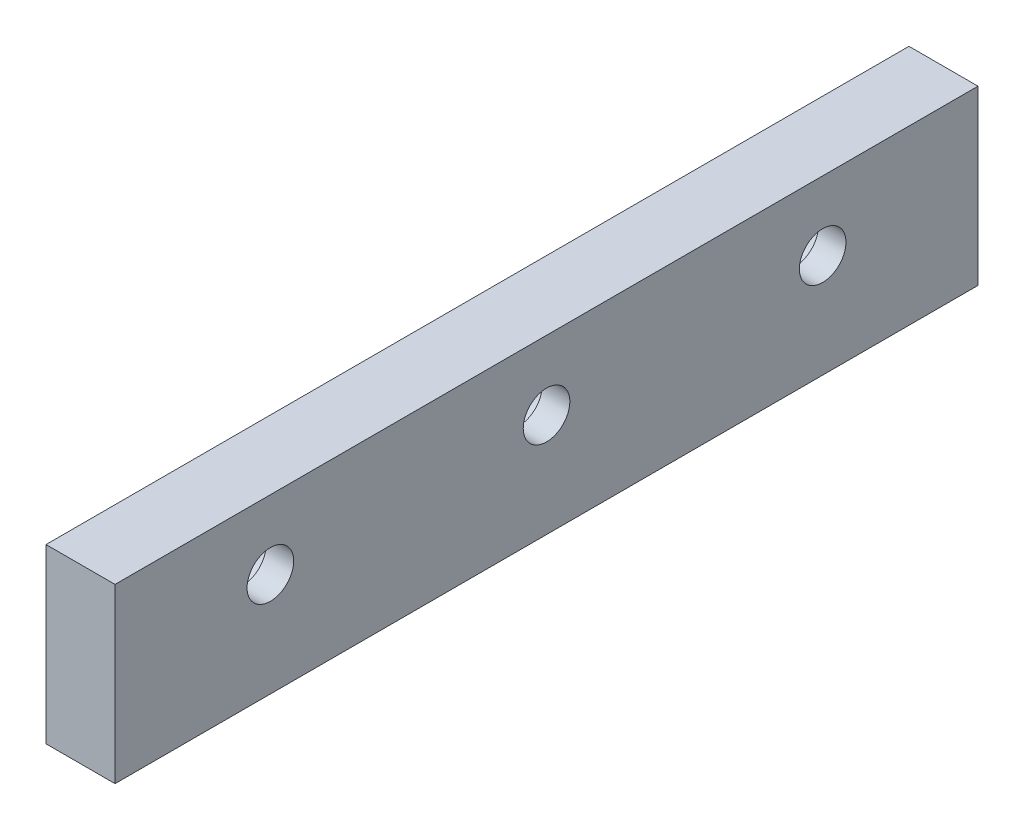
SolidWorks part; units mm, degrees
ref_plane "Plan de face" through (0, 0, 0) normal (0, 0, 1) x (1, 0, 0)
ref_plane "Plan de dessus" through (0, 0, 0) normal (0, 1, 0) x (1, 0, 0)
ref_plane "Plan de droite" through (0, 0, 0) normal (1, 0, 0) x (0, 0, -1)
sketch "Esquisse1" plane through (0, 0, 0) normal (0, 0, 1) x (1, 0, 0)
  line L1 (-20, 20) -> (0, 20)
  line L2 (-20, 20) -> (-20, -30)
  line L3 (-20, -30) -> (0, -30)
  line L4 (0, 20) -> (0, -30)
  dimension "D1" = 20
  dimension "D2" = 50
  dimension "D3" = 20
extrude "Boss.-Extru.1" add sketch "Esquisse1" along normal mid plane 250
hole_wizard "Chambrage pour vis à tête hexagonale M121" positions "Esquisse3" profile "Esquisse2" counterbore size "M12" standard "ISO"
sketch "Esquisse3" plane through (-20, 0, 0) normal (-1, 0, 0) x (0, 0, 1)
  point P0 (0, 0)
  point P1 (80, 0)
  point P3 (-80, 0)
  dimension "D1" = 80
  dimension "D2" = 80
sketch "Esquisse2" plane through (-20, 0, 0) normal (0, 1, 0) x (0, 0, 1)
  line L0 (0, 0) -> (0, 20)
  line L1 (0, 20) -> (6.75, 20)
  line L3 (6.75, 20) -> (6.75, 12)
  line L4 (6.75, 12) -> (10, 12)
  line L5 (10, 12) -> (10, 0)
  line L7 (10, 0) -> (0, 0)
  line L11 (0, -6.35) -> (0, 107.95) construction
  dimension "Diamètre du perçage jusqu'au prochain" = 13.5
  dimension "Profondeur du perçage jusqu'au prochain" = 20
  dimension "Diamètre du chambrage" = 20
  dimension "Profondeur du chambrage" = 12
